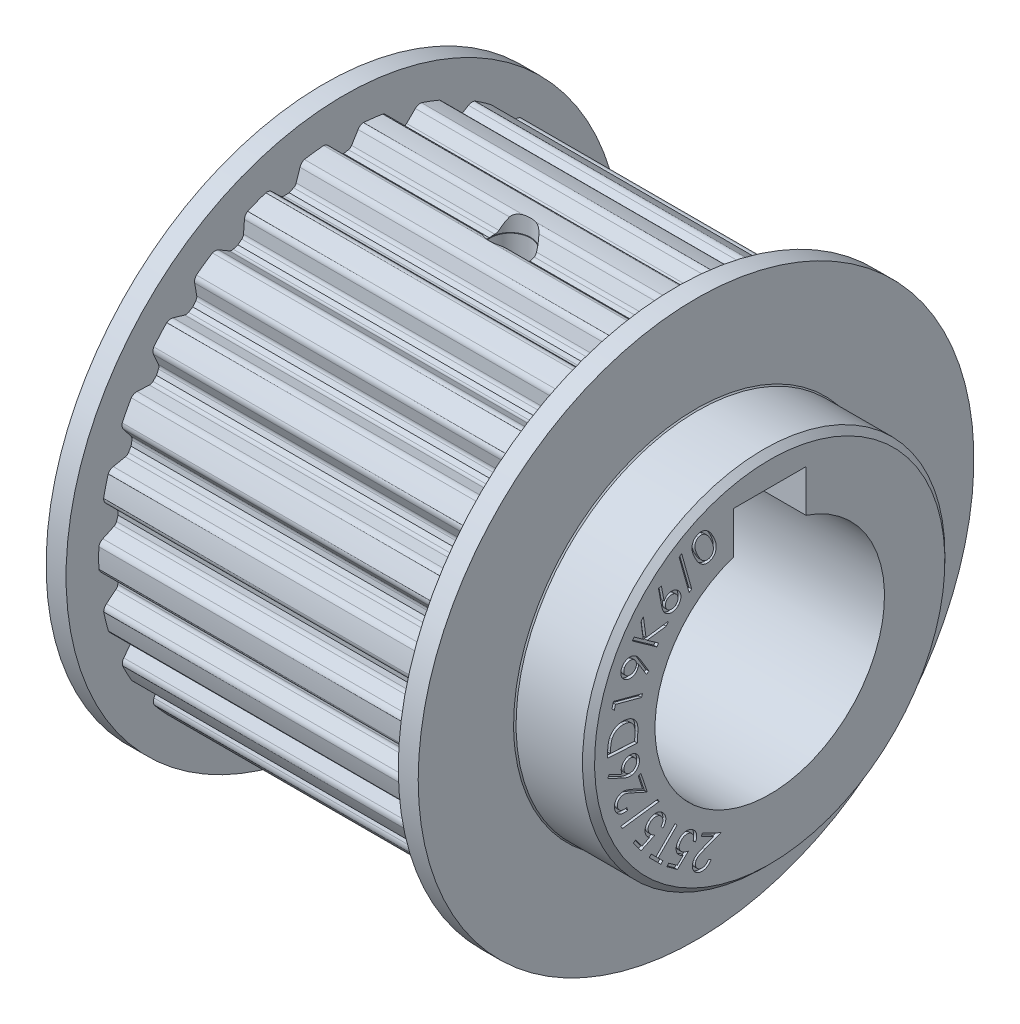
SolidWorks part; units mm, degrees
ref_plane "Front Plane" through (0, 0, 0) normal (0, 0, 1) x (1, 0, 0)
ref_plane "Top Plane" through (0, 0, 0) normal (0, 1, 0) x (1, 0, 0)
ref_plane "Right Plane" through (0, 0, 0) normal (1, 0, 0) x (0, 0, -1)
imported_body "Imported1"
sketch "Sketch1" plane through (30, 0, 0) normal (1, 0, 0) x (0, 0, -1)
  circle A0 centre (0, 0) radius 15
  dimension "D1" = 30
extrude "Boss-Extrude1" add sketch "Sketch1" along normal blind 6.5
chamfer "Chamfer1" distance 0.5 angle 45 2 edges at (30, 0, -15) (36.5, 0, -15)
sketch "Sketch5" plane through (0, 0, 0) normal (-1, 0, 0) x (0, 0, 1)
  circle A0 centre (0, 0) radius 17.5
  dimension "D1" = 35
extrude "Boss-Extrude4" add sketch "Sketch5" along normal blind 1
chamfer "Chamfer2" distance 1 angle 45 1 edges at (-1, 0, 17.5)
move or copy body "Body-Move/Copy1" bodies to move or copy 106 copy no rotation origin (0, 0, 0) rotation axis (1, 0, 0) rotation angle 7
sketch "Sketch8" plane through (36.5, 0, 0) normal (1, 0, 0) x (0, 0, -1)
  line L2 (-3, 9.0139) -> (-3, 12.5)
  line L3 (-3, 12.5) -> (3, 12.5)
  line L4 (3, 9.0139) -> (3, 12.5)
  line L5 (0, 9.5) -> (3, 12.5) construction
  line L6 (-3, 12.5) -> (0, 9.5) construction
  arc A0 (-3, 9.0139) -> (3, 9.0139) centre (0, 0) ccw
  point P3 (0, 9.5)
  point P8 (0, 12.5)
  dimension "D1" = 19
  dimension "D2" = 6
  dimension "D3" = 3
extrude "Cut-Extrude3" cut sketch "Sketch8" against normal through all
sketch "Sketch9" plane through (0, 12.5, 0) normal (0, -1, 0) x (1, 0, 0)
  line L0 (1, -0.0253) -> (29, -0.0253) construction
  point P0 (15, -0.0253)
hole_wizard "M4 Tapped Hole1" positions "Sketch9" profile "Sketch10" tap size "M4" standard "DIN"
sketch "Sketch10" plane through (15, 12.5, -0.0253) normal (1, 0, 0) x (0, 0, -1)
  line L0 (0, 0) -> (0, 6.3406)
  line L1 (0, 6.3406) -> (1.675, 6.3406)
  line L2 (1.65, 6.3156) -> (1.65, 0)
  line L5 (1.65, 0) -> (0, 0)
  line L7 (1.675, 6.3406) -> (1.65, 6.3156)
  line L8 (-1.675, 6.3406) -> (-1.65, 6.3156) construction
  line L11 (0, -6.35) -> (0, 107.95) construction
  dimension "Thru Tap Drill Dia." = 3.3
  dimension "Thru Tap Drill Depth" = 6.3406
  dimension "Far C'Sink Dia." = 3.35
  dimension "Far C'Sink Angle" = 90
sketch "Sketch11" plane through (29, 0, 0) normal (-1, 0, 0) x (0, 0, 1)
  circle A1 centre (0, 0) radius 21
  circle A2 centre (0, 0) radius 21
  dimension "D1" = 0
extrude "Boss-Extrude5" add sketch "Sketch11" along normal blind 0.25 contours A2
sketch "Sketch12" plane through (1, 0, 0) normal (1, 0, 0) x (0, 0, -1)
  circle A1 centre (0, 0) radius 21
  circle A2 centre (0, 0) radius 21
  dimension "D1" = 0
extrude "Boss-Extrude6" add sketch "Sketch12" along normal blind 0.25
ref_plane "Plane1" through (1.25, 0, 0) normal (1, 0, 0) x (0, 0, -1)
sketch "Sketch13" plane through (1.25, 0, 0) normal (1, 0, 0) x (0, 0, -1)
  circle A0 centre (0, 0) radius 15
  circle A2 centre (0, 0) radius 23
  dimension "D1" = 8
extrude "Boss-Extrude7" add sketch "Sketch13" against normal blind 1.65
ref_plane "Plane2" through (28.75, 0, 0) normal (-1, 0, 0) x (0, 0, 1)
sketch "Sketch14" plane through (28.75, 0, 0) normal (-1, 0, 0) x (0, 0, 1)
  circle A0 centre (0, 0) radius 15
  circle A1 centre (0, 0) radius 23
  dimension "D1" = 8
extrude "Boss-Extrude8" add sketch "Sketch14" against normal blind 1.65
sketch "Sketch15" plane through (1, 0, 0) normal (-1, 0, 0) x (0, 0, 1)
  line L3 (3, 12.5) -> (-3, 12.5)
  line L4 (-3, 12.5) -> (-3, 9.0139)
  line L5 (3, 9.0139) -> (3, 12.5)
  line L6 (3, 12.5) -> (-3, 12.5)
  line L7 (-3, 12.5) -> (-3, 9.0139)
  line L8 (3, 9.0139) -> (3, 12.5)
  arc A1 (-3, 9.0139) -> (3, 9.0139) centre (0, 0) ccw
  arc A2 (-3, 9.0139) -> (3, 9.0139) centre (0, 0) ccw
  dimension "D1" = 0
extrude "Cut-Extrude4" cut sketch "Sketch15" against normal through all
sketch "Sketch16" plane through (36.5, 0, 0) normal (1, 0, 0) x (0, 0, -1)
  circle A0 centre (0, 0) radius 11 construction
  text T0 "25T5/26D19K6/0" font "Century Gothic" height 2.5
extrude "Cut-Extrude5" cut sketch "Sketch16" against normal blind 0.25
